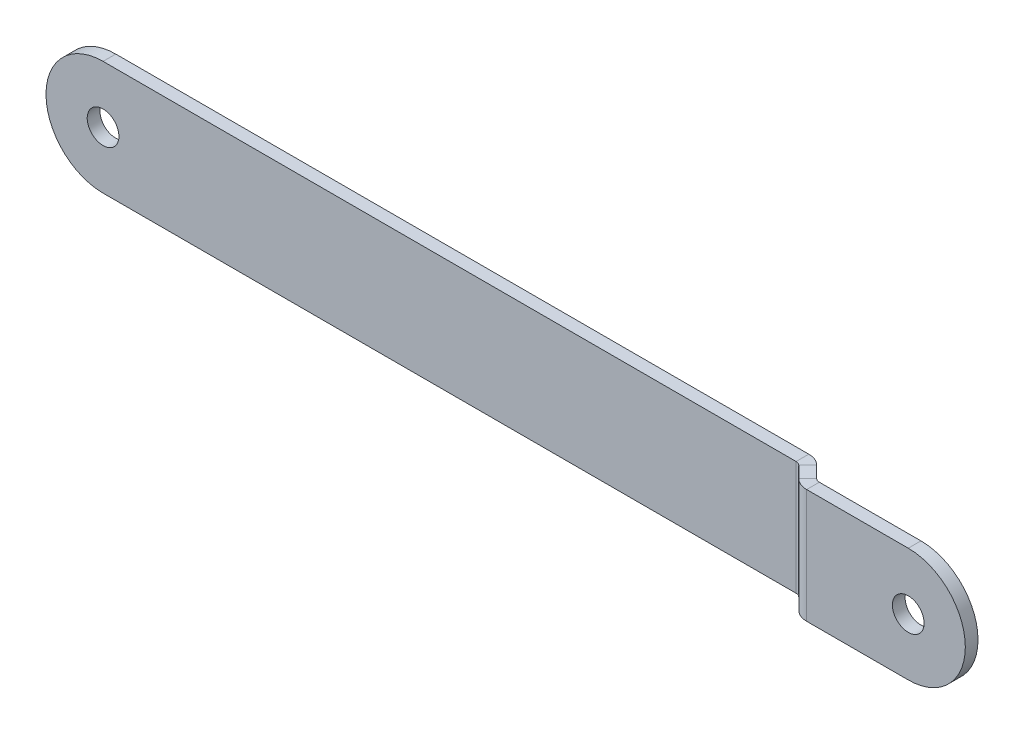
SolidWorks part; units mm, degrees
ref_plane "Plan de face" through (0, 0, 0) normal (0, 0, 1) x (1, 0, 0)
ref_plane "Plan de dessus" through (0, 0, 0) normal (0, 1, 0) x (1, 0, 0)
ref_plane "Plan de droite" through (0, 0, 0) normal (1, 0, 0) x (0, 0, -1)
sketch "Esquisse1" plane through (0, 0, 0) normal (0, 0, 1) x (1, 0, 0)
  line L0 (-65, 0) -> (65, 0) construction
  line L1 (-65, 9) -> (65, 9)
  line L2 (-65, -9) -> (65, -9)
  arc A0 (-65, 9) -> (-65, -9) centre (-65, 0) ccw
  arc A1 (65, -9) -> (65, 9) centre (65, 0) ccw
  circle A2 centre (-65, 0) radius 2.5
  circle A3 centre (65, 0) radius 2.5
  point P2 (0, 0)
  dimension "D2" = 9
  dimension "D3" = 5
  dimension "D1" = 130
sheet metal parameters "Tôlerie1" thickness 2 parameters "D1"=1
base flange "Tôle de base pliée1" sketch "Esquisse1" thickness 2 reverse thickness direction no parameters "D1"=1
sketch "Esquisse2" plane through (0, 0, 0) normal (0, 0, 1) x (1, 0, 0)
  line L0 (45, 9) -> (45, -9)
  line L1 (65, 9) -> (-65, 9) construction
  line L2 (-65, -9) -> (65, -9) construction
  circle A0 centre (65, 0) radius 2.5 construction
  dimension "D1" = 20
jog "Décalage1" parameters "D1"=1
bend "DécalagePli1" bend radius 1 bend angle 45 parameters "D5"=1
bend "DécalagePli2" bend radius 1 bend angle 45 parameters "D5"=2
flat pattern "Etat déplié1"
sketch "Lignes de pliage1" plane through (0, 0, 0) normal (0, 0, 1) x (1, 0, 0)
  line L0 (48.9587, -9) -> (48.9587, 9) construction
  line L1 (45, -9) -> (45, 9) construction
  line L2 (48.9587, -9) -> (48.9587, 9) construction
  line L3 (45, -9) -> (45, 9) construction
sketch3d "Cube de visualisation1" [suppressed]
  line L0 (-8.9999, -9, 0) -> (139.6746, -9, 0) construction
  line L1 (-8.9999, 9, 0) -> (139.6746, 9, 0) construction
  line L2 (-8.9999, -9, 0) -> (-8.9999, 9, 0) construction
  line L3 (139.6746, -9, 0) -> (139.6746, 9, 0) construction
bend of the flat pattern "Dépliage-<DécalagePli1>1"
bend of the flat pattern "Dépliage-<DécalagePli2>1"
